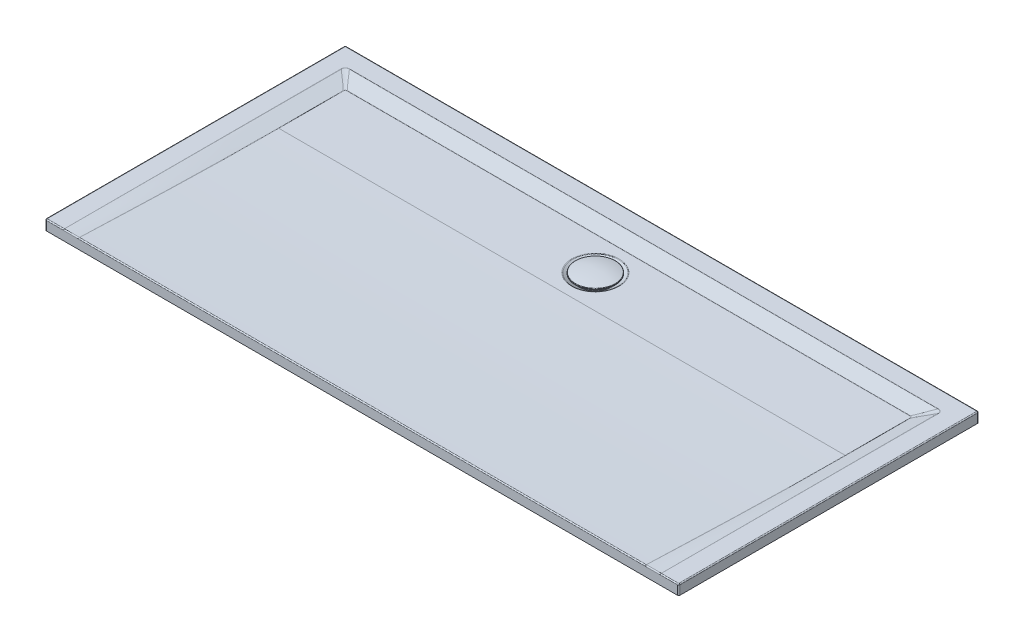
SolidWorks part; units mm, degrees
ref_plane "Płaszczyzna przednia" through (0, 0, 0) normal (0, 0, 1) x (1, 0, 0)
ref_plane "Płaszczyzna górna" through (0, 0, 0) normal (0, 1, 0) x (1, 0, 0)
ref_plane "Płaszczyzna prawa" through (0, 0, 0) normal (1, 0, 0) x (0, 0, -1)
sketch "Szkic1" plane through (0, 0, 0) normal (0, 1, 0) x (1, 0, 0)
  line L0 (0, 450) -> (0, -450) construction
  line L1 (-950, 450) -> (950, 450)
  line L2 (-950, 450) -> (-950, -450)
  line L3 (-950, -450) -> (950, -450)
  line L4 (950, 450) -> (950, -450)
  line L5 (-895, -450) -> (-895, 395)
  line L6 (-895, 395) -> (895, 395)
  line L7 (895, 395) -> (895, -450)
  line L8 (-850, -450) -> (-850, 350)
  line L9 (-850, 350) -> (850, 350)
  line L10 (850, 350) -> (850, -450)
  circle A0 centre (0, 250) radius 45
  circle A1 centre (0, 250) radius 70
  point P9 (0, 395)
  dimension "D6" = 90
  dimension "D7" = 140
  dimension "D1" = 1900
  dimension "D2" = 55
  dimension "D3" = 55
  dimension "D5" = 200
  dimension "D8" = 900
  dimension "D4" = 45
sketch "Szkic2" plane through (0, 0, 0) normal (0, 1, 0) x (1, 0, 0)
  line L0 (-950, -450) -> (950, -450) construction
  line L1 (950, 450) -> (950, -450) construction
  line L2 (895, 395) -> (895, -450) construction
  line L3 (-895, 395) -> (895, 395) construction
  line L4 (-950, 450) -> (950, 450) construction
  line L5 (-895, -450) -> (-895, 395) construction
  line L6 (-950, 450) -> (-950, -450) construction
  line L7 (-950, -450) -> (-895, -450)
  line L8 (950, 450) -> (950, -450)
  line L9 (895, 395) -> (895, -450)
  line L10 (-895, 395) -> (895, 395)
  line L11 (-950, 450) -> (950, 450)
  line L12 (-895, -450) -> (-895, 395)
  line L13 (-950, 450) -> (-950, -450)
  line L14 (895, -450) -> (950, -450)
surface "Powierzchnia-Płaszczyzna1" sketch "Szkic2"
ref_plane "Płaszczyzna1" through (0, -15, 0) normal (0, 1, 0) x (-1, 0, 0)
sketch "Szkic3" plane through (0, -15, 0) normal (0, 1, 0) x (-1, 0, 0)
  line L0 (850, -150) -> (-850, -150)
  line L1 (850, 450) -> (850, -350) construction
  line L2 (-850, -350) -> (-850, 450) construction
  line L3 (0, -150) -> (0, -350) construction
  line L4 (850, -350) -> (-850, -350) construction
  line L5 (-850, -350) -> (-850, -150)
  line L6 (850, -150) -> (850, -350)
  line L7 (850, -350) -> (-850, -350)
  circle A0 centre (0, -250) radius 70 construction
  circle A1 centre (0, -250) radius 70
  point P10 (0, -250)
surface "Powierzchnia-Płaszczyzna2" sketch "Szkic3"
sketch "Szkic4" plane through (0, 0, 0) normal (0, 1, 0) x (1, 0, 0)
  line L0 (850, -450) -> (-850, -450)
other "Granica-Powierzchnia1"
other "Granica-Powierzchnia2"
other "Granica-Powierzchnia3"
mirror "Lustro1" about plane through (0, 0, 0) normal (1, 0, 0)
sketch "Szkic5" plane through (0, 0, 0) normal (0, 1, 0) x (1, 0, 0)
  line L0 (950, 450) -> (950, -450) construction
  line L1 (-950, 450) -> (950, 450) construction
  line L2 (-950, 450) -> (-950, -450) construction
  line L3 (-950, -450) -> (950, -450) construction
  line L4 (950, 450) -> (950, -450)
  line L5 (-950, 450) -> (950, 450)
  line L6 (-950, 450) -> (-950, -450)
  line L7 (-950, -450) -> (950, -450)
surface "Powierzchnia-Wyciągnięcie1" sketch "Szkic5" parameters "D1"=30
sketch "Szkic7" plane through (0, 0, 0) normal (1, 0, 0) x (0, 0, -1)
  line L0 (250, 0) -> (250, -30) construction
  line L1 (450, -30) -> (-450, -30) construction
  line L2 (295, -30) -> (295, -28)
  line L3 (295, -28) -> (299, -28)
  line L6 (299, -28) -> (320, -15)
  dimension "D1" = 90
  dimension "D2" = 2
  dimension "D3" = 98
surface "Powierzchnia-Obrót wokół linii środkowej1" sketch "Szkic7" parameters "D1"=360
surface "Powierzchnia-Płaszczyzna3"
surface "Powierzchnia-Połącz1"
fillet "Zaokrąglenie1" radius 4 6 edges at (0, -28, -299) (0, -15, -180) (950, -15, 450) (950, -15, -450) (-950, -15, -450) (-950, -15, 450)
fillet "Zmienne zaokrąglenie1" radius 40 2 edges at (872.5, -7.5, -372.5)
fillet "Zaokrąglenie3" radius 3 12 edges
fillet "Zaokrąglenie4" radius 3 12 edges at (-948.8284, 0, -448.8284) (0, 0, -450) (948.8284, 0, -448.8284) (950, 0, 0) (948.8284, 0, 448.8284) (920.5, 0, 450) (-920.5, 0, 450) (-948.8284, 0, 448.8284) (-950, 0, 0)
sketch "Szkic8" plane through (0, 0, 0) normal (1, 0, 0) x (0, 0, -1)
  line L0 (250, 0) -> (250, -30) construction
  line L1 (250, -5.6601) -> (179.8469, -5.6601) construction
  line L2 (310, -14.7573) -> (310, -17)
  line L3 (310, -17) -> (250, -17)
  line L4 (250, -17) -> (250, -5.6601)
  line L5 (250, -5.6601) -> (199.9922, 95.6514)
  arc A0 (250, -5.6601) -> (309.2694, -13.7943) centre (250, -225.6601) cw
  arc A1 (309.2694, -13.7943) -> (310, -14.7573) centre (309, -14.7573) cw
  point P11 (310, -14)
  dimension "D1" = 220
  dimension "D4" = 1
  dimension "D2" = 60
  dimension "D3" = 3
  dimension "D5" = 13
revolve "Obrót wokół linii środkowej1" add sketch "Szkic8" angle 360 about L4
